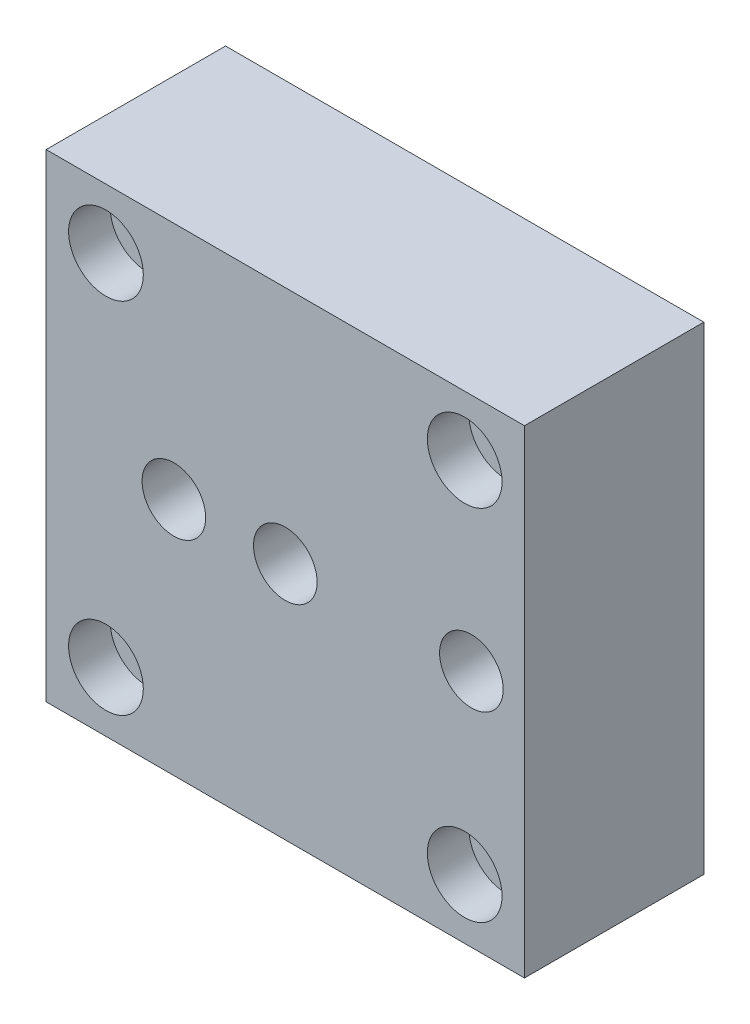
SolidWorks part; units mm, degrees
ref_plane "Front Plane" through (0, 0, 0) normal (0, 0, 1) x (1, 0, 0)
ref_plane "Top Plane" through (0, 0, 0) normal (0, 1, 0) x (1, 0, 0)
ref_plane "Right Plane" through (0, 0, 0) normal (1, 0, 0) x (0, 0, -1)
sketch "Sketch1" plane through (0, 0, 0) normal (0, 0, 1) x (1, 0, 0)
  line L1 (-25.4, 25.4) -> (25.4, 25.4)
  line L2 (-25.4, 25.4) -> (-25.4, -25.4)
  line L3 (-25.4, -25.4) -> (25.4, -25.4)
  line L4 (25.4, 25.4) -> (25.4, -25.4)
  line L5 (-25.4, 25.4) -> (25.4, -25.4) construction
  line L6 (-25.4, -25.4) -> (25.4, 25.4) construction
  point P0 (0, 0)
  dimension "D1" = 50.8
  dimension "D2" = 50.8
extrude "Boss-Extrude1" add sketch "Sketch1" along normal blind 19.05
sketch "Sketch2" plane through (0, 0, 19.05) normal (0, 0, 1) x (1, 0, 0)
  line L0 (0, 25.4) -> (0, -25.4) construction
  line L3 (-25.4, 25.4) -> (-25.4, -25.4) construction
  line L7 (25.4, 25.4) -> (-25.4, 25.4) construction
  line L8 (-25.4, -25.4) -> (25.4, -25.4) construction
  line L9 (-25.4, 0) -> (25.4, 0) construction
  line L10 (25.4, -25.4) -> (25.4, 25.4) construction
  circle A1 centre (-19.05, 19.05) radius 1.5875 construction
  circle A2 centre (19.05, 19.05) radius 1.5875 construction
  circle A3 centre (19.05, -19.05) radius 1.5875 construction
  circle A4 centre (-19.05, -19.05) radius 1.5875 construction
  dimension "D2" = 3.175
  dimension "D3" = 6.35
  dimension "D4" = 6.35
hole_wizard "CBORE for #8 Binding Head Machine Screw1" positions "Sketch3" profile "Sketch4" counterbore size "#8" standard "ANSI Inch"
sketch "Sketch3" plane through (0, 0, 19.05) normal (0, 0, 1) x (1, 0, 0)
  point P0 (-19.05, 19.05)
  point P3 (19.05, 19.05)
  point P6 (-19.05, -19.05)
  point P9 (19.05, -19.05)
sketch "Sketch4" plane through (-19.05, 19.05, 19.05) normal (1, 0, 0) x (0, -1, 0)
  line L0 (0, 0) -> (0, 19.05)
  line L1 (0, 19.05) -> (2.1526, 19.05)
  line L3 (2.1526, 19.05) -> (2.1527, 4.4196)
  line L4 (2.1527, 4.4196) -> (3.9687, 4.4196)
  line L5 (3.9687, 4.4196) -> (3.9687, 0)
  line L7 (3.9687, 0) -> (0, 0)
  line L11 (0, -6.35) -> (0, 107.95) construction
  dimension "Thru Hole Dia." = 4.3053
  dimension "Thru Hole Depth" = 19.05
  dimension "C'Bore Dia." = 7.9375
  dimension "C'Bore Depth" = 4.4196
sketch "Sketch5" plane through (0, 0, 19.05) normal (0, 0, 1) x (1, 0, 0)
  circle A0 centre (0, 0) radius 3.3782
  dimension "D1" = 6.7564
extrude "Cut-Extrude1" cut sketch "Sketch5" against normal through all
sketch "Sketch6" plane through (0, 0, 19.05) normal (0, 0, 1) x (1, 0, 0)
  line L0 (25.4, -25.4) -> (25.4, 25.4) construction
  circle A0 centre (19.7612, 0) radius 3.3782
  circle A1 centre (-11.8364, 0) radius 3.3782
  dimension "D1" = 6.7564
  dimension "D2" = 6.7564
  dimension "D3" = 5.6388
  dimension "D4" = 37.2364
extrude "Cut-Extrude2" cut sketch "Sketch6" against normal through all
